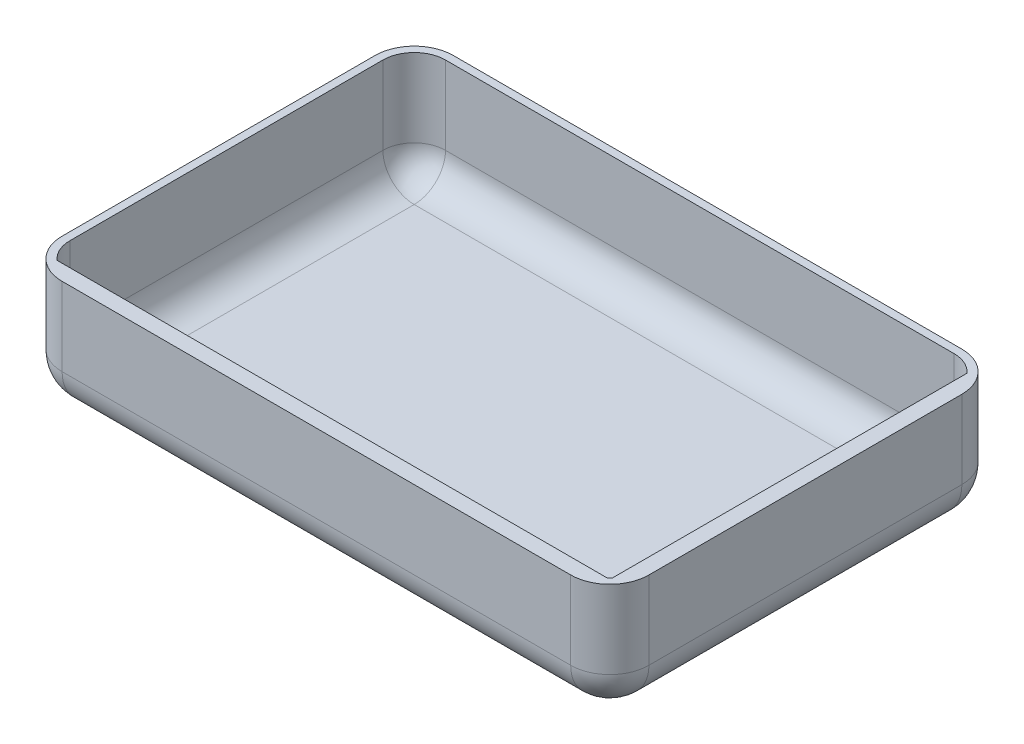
SolidWorks part; units mm, degrees
ref_plane "Front" through (0, 0, 0) normal (0, 0, 1) x (1, 0, 0)
ref_plane "Top" through (0, 0, 0) normal (0, 1, 0) x (1, 0, 0)
ref_plane "Right" through (0, 0, 0) normal (1, 0, 0) x (0, 0, -1)
sketch "Sketch2" plane through (0, 0, 0) normal (0, 1, 0) x (1, 0, 0)
  line L0 (75, -50) -> (-75, 50) construction
  line L1 (-75, 50) -> (75, 50)
  line L2 (-75, 50) -> (-75, -50)
  line L3 (-75, -50) -> (75, -50)
  line L4 (75, 50) -> (75, -50)
  dimension "D1" = 150
  dimension "D2" = 100
extrude "Extrude1" add sketch "Sketch2" along normal blind 30
fillet "Fillet1" radius 10 8 edges at (0, 0, 50) (75, 0, 0) (0, 0, -50) (-75, 0, 0) (-75, 15, -50) (-75, 15, 50) (75, 15, -50) (75, 15, 50)
shell "Shell2" thickness 2
